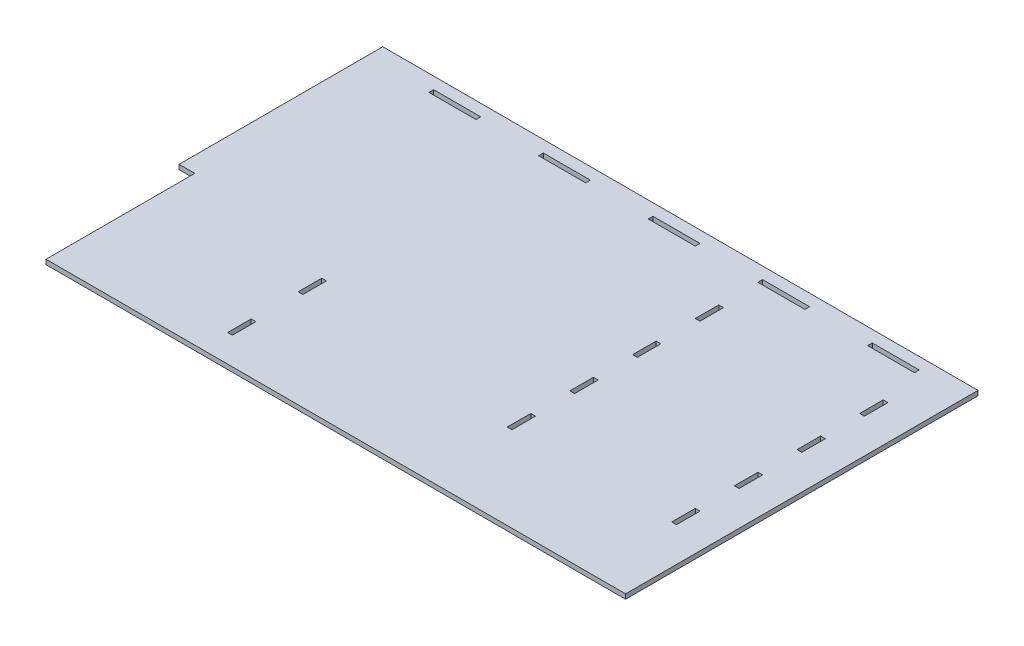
SolidWorks part; units mm, degrees
ref_plane "Front Plane" through (0, 0, 0) normal (0, 0, 1) x (1, 0, 0)
ref_plane "Top Plane" through (0, 0, 0) normal (0, 1, 0) x (1, 0, 0)
ref_plane "Right Plane" through (0, 0, 0) normal (1, 0, 0) x (0, 0, -1)
sketch "Sketch1" plane through (0, 0, 0) normal (0, 1, 0) x (1, 0, 0)
  line L0 (0, 0) -> (0, 225)
  line L1 (0, 225) -> (390, 225)
  line L2 (390, 225) -> (390, 0)
  line L3 (390, 0) -> (0, 0)
extrude "Boss-Extrude1" add sketch "Sketch1" along normal blind 3
sketch "Sketch2" plane through (0, 3, 0) normal (0, 1, 0) x (1, 0, 0)
  line L0 (0, 225) -> (0, 217.5) construction
  line L1 (0, 225) -> (0, 0) construction
  line L2 (350, 217.5) -> (390, 217.5) construction
  line L4 (0, 217.5) -> (40, 217.5) construction
  line L5 (40, 217.5) -> (70, 217.5) construction
  line L6 (70, 217.5) -> (110, 217.5) construction
  line L7 (110, 217.5) -> (140, 217.5) construction
  line L8 (140, 217.5) -> (180, 217.5) construction
  line L9 (180, 217.5) -> (210, 217.5) construction
  line L10 (210, 217.5) -> (250, 217.5) construction
  line L11 (250, 217.5) -> (280, 217.5) construction
  line L12 (280, 217.5) -> (320, 217.5) construction
  line L13 (320, 217.5) -> (350, 217.5) construction
  line L15 (40, 217.5) -> (70, 217.5)
  line L16 (70, 217.5) -> (70, 214.5)
  line L17 (70, 214.5) -> (40, 214.5)
  line L18 (40, 214.5) -> (40, 217.5)
  line L19 (140, 217.5) -> (110, 217.5)
  line L20 (110, 217.5) -> (110, 214.5)
  line L21 (110, 214.5) -> (140, 214.5)
  line L22 (140, 214.5) -> (140, 217.5)
  line L23 (180, 217.5) -> (210, 217.5)
  line L24 (210, 217.5) -> (210, 214.5)
  line L25 (210, 214.5) -> (180, 214.5)
  line L26 (180, 214.5) -> (180, 217.5)
  line L27 (280, 217.5) -> (250, 217.5)
  line L28 (250, 217.5) -> (250, 214.5)
  line L29 (250, 214.5) -> (280, 214.5)
  line L30 (280, 214.5) -> (280, 217.5)
  line L31 (320, 217.5) -> (350, 217.5)
  line L32 (350, 214.5) -> (320, 214.5)
  line L33 (320, 214.5) -> (320, 217.5)
  line L34 (350, 217.5) -> (350, 214.5)
  line L35 (390, 0) -> (390, 225) construction
  dimension "D1" = 40
  dimension "D2" = 30
  dimension "D3" = 40
  dimension "D4" = 30
  dimension "D5" = 40
  dimension "D6" = 30
  dimension "D7" = 40
  dimension "D8" = 30
  dimension "D9" = 40
  dimension "D10" = 30
  dimension "D11" = 7.5
extrude "Cut-Extrude1" cut sketch "Sketch2" against normal blind 3
sketch "Sketch4" plane through (0, 3, 0) normal (0, 1, 0) x (1, 0, 0)
  line L0 (390, 225) -> (390, 0)
  line L1 (390, 0) -> (380, 0)
  line L2 (0, 0) -> (390, 0) construction
  line L3 (380, 0) -> (380, 225)
  line L4 (390, 225) -> (0, 225) construction
  line L5 (380, 225) -> (390, 225)
extrude "Cut-Extrude2" cut sketch "Sketch4" against normal blind 10
sketch "Sketch6" plane through (0, 3, 0) normal (0, 1, 0) x (1, 0, 0)
  line L0 (0, 225) -> (0, 95) construction
  line L1 (0, 225) -> (0, 0) construction
  line L2 (0, 95) -> (10, 95)
  line L3 (10, 95) -> (10, 0)
  line L4 (0, 0) -> (380, 0) construction
  line L5 (10, 0) -> (0, 0)
  line L6 (0, 0) -> (0, 95)
extrude "Cut-Extrude4" cut sketch "Sketch6" against normal blind 3
sketch "Sketch7" plane through (0, 3, 0) normal (0, 1, 0) x (1, 0, 0)
  line L0 (250, 214.5) -> (250, 189.5) construction
  line L1 (250, 189.5) -> (250, 174.5) construction
  line L2 (250, 174.5) -> (250, 149.5) construction
  line L3 (250, 149.5) -> (250, 134.5) construction
  line L4 (250, 134.5) -> (250, 109.5) construction
  line L5 (250, 109.5) -> (250, 94.5) construction
  line L6 (250, 94.5) -> (250, 69.5) construction
  line L7 (250, 69.5) -> (250, 54.5) construction
  line L8 (250, 189.5) -> (250, 174.5)
  line L9 (250, 174.5) -> (253, 174.5)
  line L10 (253, 174.5) -> (253, 189.5)
  line L11 (253, 189.5) -> (250, 189.5)
  line L12 (250, 149.5) -> (253, 149.5)
  line L13 (253, 149.5) -> (253, 134.5)
  line L14 (253, 134.5) -> (250, 134.5)
  line L15 (250, 134.5) -> (250, 149.5)
  line L16 (250, 109.5) -> (253, 109.5)
  line L17 (253, 109.5) -> (253, 94.5)
  line L18 (253, 94.5) -> (250, 94.5)
  line L19 (250, 94.5) -> (250, 109.5)
  line L20 (250, 69.5) -> (253, 69.5)
  line L21 (253, 69.5) -> (253, 54.5)
  line L22 (253, 54.5) -> (250, 54.5)
  line L23 (250, 54.5) -> (250, 69.5)
  line L24 (253, 142) -> (355, 142) construction
  line L25 (304, 142) -> (304, 28.9317) construction
  line L26 (358, 69.5) -> (358, 54.5) construction
  line L27 (358, 94.5) -> (358, 69.5) construction
  line L28 (358, 109.5) -> (358, 94.5) construction
  line L29 (358, 134.5) -> (358, 109.5) construction
  line L30 (358, 149.5) -> (358, 134.5) construction
  line L31 (358, 174.5) -> (358, 149.5) construction
  line L32 (358, 189.5) -> (358, 174.5) construction
  line L33 (358, 54.5) -> (358, 69.5)
  line L34 (355, 54.5) -> (358, 54.5)
  line L35 (355, 69.5) -> (355, 54.5)
  line L36 (358, 69.5) -> (355, 69.5)
  line L37 (358, 94.5) -> (358, 109.5)
  line L38 (355, 94.5) -> (358, 94.5)
  line L39 (355, 109.5) -> (355, 94.5)
  line L40 (358, 109.5) -> (355, 109.5)
  line L41 (358, 134.5) -> (358, 149.5)
  line L42 (355, 134.5) -> (358, 134.5)
  line L43 (355, 149.5) -> (355, 134.5)
  line L44 (358, 149.5) -> (355, 149.5)
  line L45 (355, 189.5) -> (358, 189.5)
  line L46 (355, 174.5) -> (355, 189.5)
  line L47 (358, 174.5) -> (355, 174.5)
  line L48 (358, 189.5) -> (358, 174.5)
  dimension "D1" = 25
  dimension "D2" = 15
  dimension "D3" = 25
  dimension "D4" = 15
  dimension "D5" = 25
  dimension "D6" = 15
  dimension "D7" = 25
  dimension "D8" = 15
extrude "Cut-Extrude5" cut sketch "Sketch7" against normal blind 10
sketch "Sketch9" plane through (0, 3, 0) normal (0, 1, 0) x (1, 0, 0)
  line L0 (10, 95) -> (10, 0) construction
  line L1 (10, 47.5) -> (110, 47.5) construction
  line L2 (110, 47.5) -> (110, 62.5) construction
  line L3 (110, 47.5) -> (110, 32.5) construction
  line L4 (110, 62.5) -> (111.5, 62.5)
  line L5 (111.5, 62.5) -> (111.5, 77.5)
  line L6 (111.5, 77.5) -> (108.5, 77.5)
  line L7 (108.5, 77.5) -> (108.5, 62.5)
  line L8 (108.5, 62.5) -> (110, 62.5)
  line L9 (110, 32.5) -> (111.5, 32.5)
  line L10 (111.5, 32.5) -> (111.5, 17.5)
  line L11 (111.5, 17.5) -> (108.5, 17.5)
  line L12 (108.5, 17.5) -> (108.5, 32.5)
  line L13 (108.5, 32.5) -> (110, 32.5)
extrude "Cut-Extrude6" cut sketch "Sketch9" against normal through all
